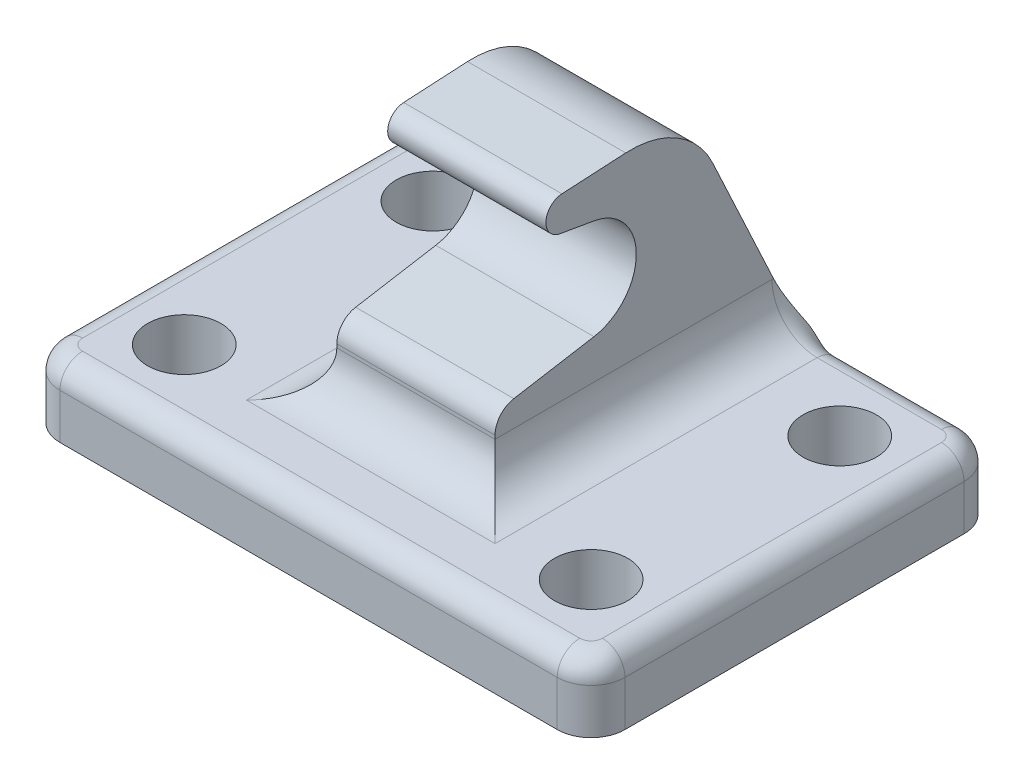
SolidWorks part; units mm, degrees
ref_plane "front" through (0, 0, 0) normal (0, 0, 1) x (1, 0, 0)
ref_plane "top" through (0, 0, 0) normal (0, 1, 0) x (1, 0, 0)
ref_plane "right" through (0, 0, 0) normal (1, 0, 0) x (0, 0, -1)
sketch "Sketch1" plane through (0, 0, 0) normal (0, 1, 0) x (1, 0, 0)
  line L1 (0, 0) -> (79.375, 0)
  line L2 (0, 0) -> (0, 57.15)
  line L3 (0, 57.15) -> (79.375, 57.15)
  line L4 (79.375, 0) -> (79.375, 57.15)
  dimension "D1" = 79.375
  dimension "D2" = 57.15
extrude "Base-Extrude" add sketch "Sketch1" along normal blind 9.525
sketch "Sketch2" plane through (0, 9.525, 0) normal (0, 1, 0) x (-1, 0, 0)
  line L0 (0, -57.15) -> (0, 0) construction
  line L1 (0, 0) -> (-79.375, 0) construction
  circle A0 centre (-11.1125, -46.0375) radius 5.1562
  circle A1 centre (-11.1125, -11.1125) radius 5.1562
  circle A2 centre (-68.2625, -11.1125) radius 5.1562
  circle A3 centre (-68.2625, -46.0375) radius 5.1562
  dimension "D1" = 10.3124
  dimension "D2" = 34.925
  dimension "D3" = 57.15
  dimension "D4" = 11.1125
  dimension "D5" = 11.1125
extrude "Cut-Extrude1" cut sketch "Sketch2" against normal through all
ref_plane "Plane4" through (39.6875, 0, 0) normal (1, 0, 0) x (0, 0, -1)
sketch "Sketch3" plane through (39.6875, 0, 0) normal (1, 0, 0) x (0, 0, -1)
  line L0 (0, 9.525) -> (57.15, 9.525) construction
  line L1 (15.0812, 9.525) -> (57.15, 9.525)
  line L2 (57.15, 9.525) -> (45.6421, 34.2125)
  line L3 (33.436, 41.5277) -> (24.4759, 41.0365)
  line L4 (24.2027, 36.312) -> (28.992, 35.4884)
  line L5 (28.9749, 21.4047) -> (17.7257, 19.4982)
  line L6 (15.0812, 16.3678) -> (15.0812, 9.525)
  line L7 (0, 9.525) -> (0, 0) construction
  arc A0 (24.4759, 41.0365) -> (24.2027, 36.312) centre (24.6062, 38.6588) ccw
  arc A1 (28.992, 35.4884) -> (28.9749, 21.4047) centre (27.7812, 28.448) cw
  arc A2 (33.436, 41.5277) -> (45.6421, 34.2125) centre (34.1313, 28.8468) cw
  arc A3 (15.0812, 16.3678) -> (17.7257, 19.4982) centre (18.2562, 16.3678) cw
  point P18 (15.0812, 19.05)
  dimension "D1" = 12.7
  dimension "D2" = 2.3813
  dimension "D3" = 7.1437
  dimension "D5" = 29.1338
  dimension "D6" = 34.1313
  dimension "D7" = 19.3218
  dimension "D9" = 18.923
  dimension "D12" = 3.175
  dimension "D4" = 24.6062
  dimension "D8" = 27.7812
  dimension "D10" = 15.0812
  dimension "D11" = 9.525
extrude "Boss-Extrude1" add sketch "Sketch3" along normal mid plane 22.225
fillet "Fillet1" radius 4.7625 5 edges at (0, 4.7625, -57.15) (79.375, 4.7625, -57.15) (79.375, 4.7625, 0) (0, 4.7625, 0)
fillet "Fillet3" radius 3.175 9 edges at (39.6875, 9.525, 0) (0, 9.525, -28.575) (79.375, 9.525, -28.575) (77.9801, 9.525, -55.7551) (1.3949, 9.525, -55.7551) (77.9801, 9.525, -1.3949) (1.3949, 9.525, -1.3949)
fillet "Fillet5" radius 6.35 9 edges at (39.6875, 9.525, -15.0812) (28.575, 8.5951, -56.2201) (50.8, 8.5951, -56.2201)
fillet "Fillet6" radius 3.175 3 edges at (55.1094, 7.8507, -57.15) (28.3543, 14.1492, -54.9945)
